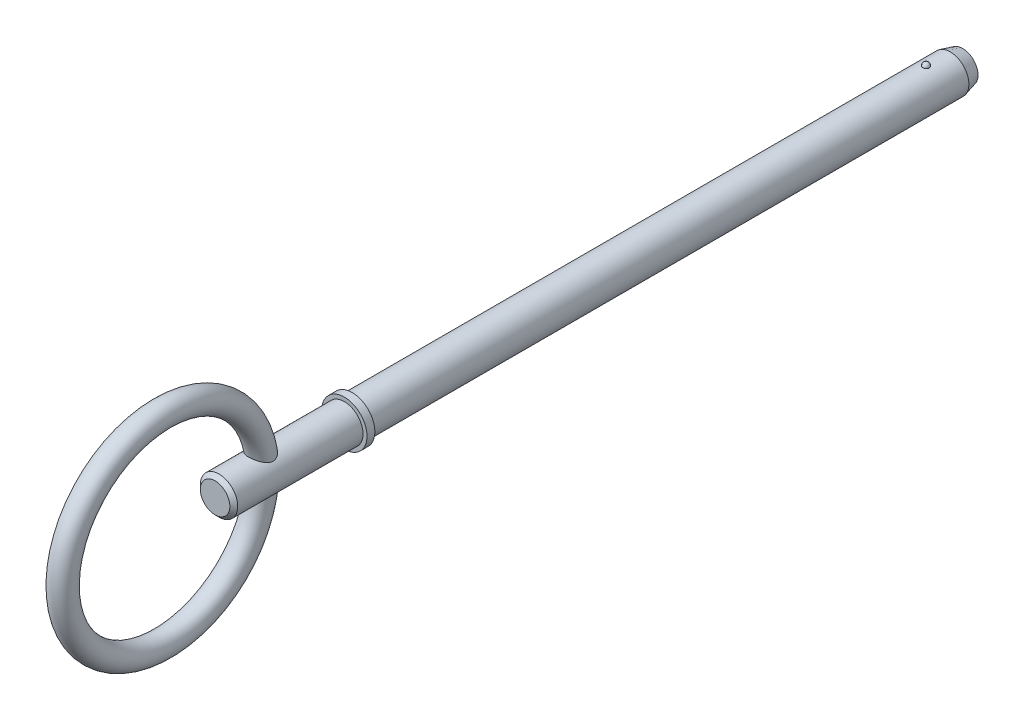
SolidWorks part; units mm, degrees
ref_plane "Front Plane" through (0, 0, 0) normal (0, 0, 1) x (1, 0, 0)
ref_plane "Top Plane" through (0, 0, 0) normal (0, 1, 0) x (1, 0, 0)
ref_plane "Right Plane" through (0, 0, 0) normal (1, 0, 0) x (0, 0, -1)
sketch "Sketch2" plane through (0, 0, 0) normal (0, 0, 1) x (1, 0, 0)
  circle A0 centre (0, 0) radius 2.38
  point P3 (0, 2.38)
  dimension "D1" = 4.76
extrude "Boss-Extrude1" add sketch "Sketch2" along normal blind 72.6
sketch "Sketch3" plane through (0, 0, 0) normal (0, 0, -1) x (-1, 0, 0)
  circle A0 centre (0, 0) radius 2.38
  dimension "D1" = 4.76
extrude "Boss-Extrude2" add sketch "Sketch3" along normal blind 5.08
chamfer "Chamfer1" distance 1.586 angle 15 1 edges at (-2.38, 0, -5.08)
sketch "Sketch18" plane through (0, 0, 0) normal (1, 0, 0) x (0, 0, -1)
  line L0 (3.494, 2.38) -> (-72.6, 2.38) construction
  line L1 (0.42, 2.8) -> (0.42, 1.96)
  line L2 (-72.6, -2.38) -> (3.494, -2.38) construction
  arc A0 (0.42, 2.8) -> (0.42, 1.96) centre (0.42, 2.38) ccw
  point P4 (0, 2.38)
  dimension "D1" = 5.18
revolve "Revolve1" add sketch "Sketch18" angle 360 about L1
sketch "Sketch19" plane through (0, 0, 0) normal (1, 0, 0) x (0, 0, -1)
  line L0 (-33.7288, 0) -> (-46.4542, 0) construction
sketch "Sketch20" plane through (0, 0, 0) normal (1, 0, 0) x (0, 0, -1)
  line L0 (-72.6, 0) -> (-72.6, 2.88)
  line L1 (-72.6, 2.38) -> (-72.6, -2.38) construction
  line L2 (-72.6, 2.88) -> (-73.6, 2.88)
  line L3 (-73.6, 2.88) -> (-73.6, 0)
  line L4 (-33.7288, 0) -> (-46.4542, 0) construction
  line L5 (-73.6, 0) -> (-72.6, 0)
  dimension "D1" = 2.88
  dimension "D2" = 1
revolve "Revolve2" add sketch "Sketch20" angle 360 about L0
sketch "Sketch21" plane through (0, 0, 72.6) normal (0, 0, -1) x (-1, 0, 0)
  circle A0 centre (0, 0) radius 2.38
  dimension "D1" = 4.76
extrude "Boss-Extrude3" add sketch "Sketch21" against normal blind 17.45
chamfer "Chamfer2" distance 0.5 angle 45 1 edges at (-2.38, 0, 90.05)
sketch "Sketch23" plane through (0, 0, 0) normal (1, 0, 0) x (0, 0, -1)
  line L0 (-90.05, 1.88) -> (-90.05, -1.88) construction
  circle A0 centre (-96.75, 0) radius 12.7
  point P2 (-84.05, 0)
  dimension "D1" = 25.4
  dimension "D2" = 6
sketch "Sketch24" plane through (0, 0, 0) normal (0, 1, 0) x (1, 0, 0)
  circle A0 centre (0, -84.05) radius 1.5
  dimension "D1" = 3
sweep "Sweep1" add profiles "Sketch24" path "Sketch23"
